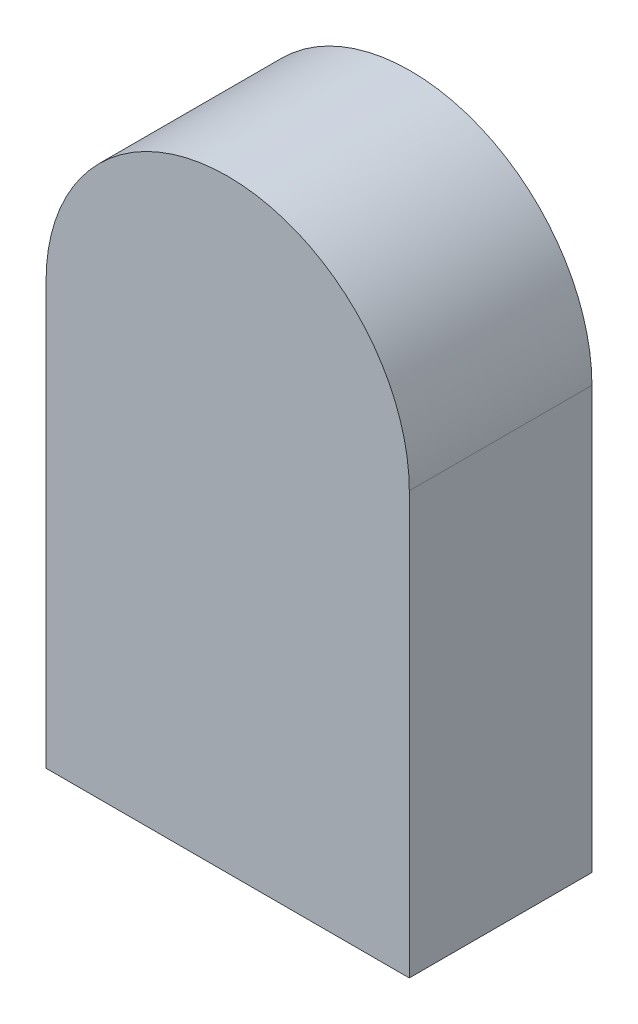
SolidWorks part; units mm, degrees
ref_plane "Front Plane" through (0, 0, 0) normal (0, 0, 1) x (1, 0, 0)
ref_plane "Top Plane" through (0, 0, 0) normal (0, 1, 0) x (1, 0, 0)
ref_plane "Right Plane" through (0, 0, 0) normal (1, 0, 0) x (0, 0, -1)
sketch "Sketch1" plane through (0, 0, 0) normal (0, 0, 1) x (1, 0, 0)
  line L0 (0, 62.0769) -> (0, 0)
  line L1 (0, 0) -> (53.4373, 0)
  line L2 (53.4373, 0) -> (53.4373, 62.0769)
  arc A0 (53.4373, 62.0769) -> (0, 62.0769) centre (26.7186, 62.0769) ccw
extrude "Extrude1" add sketch "Sketch1" along normal blind 26.8697
